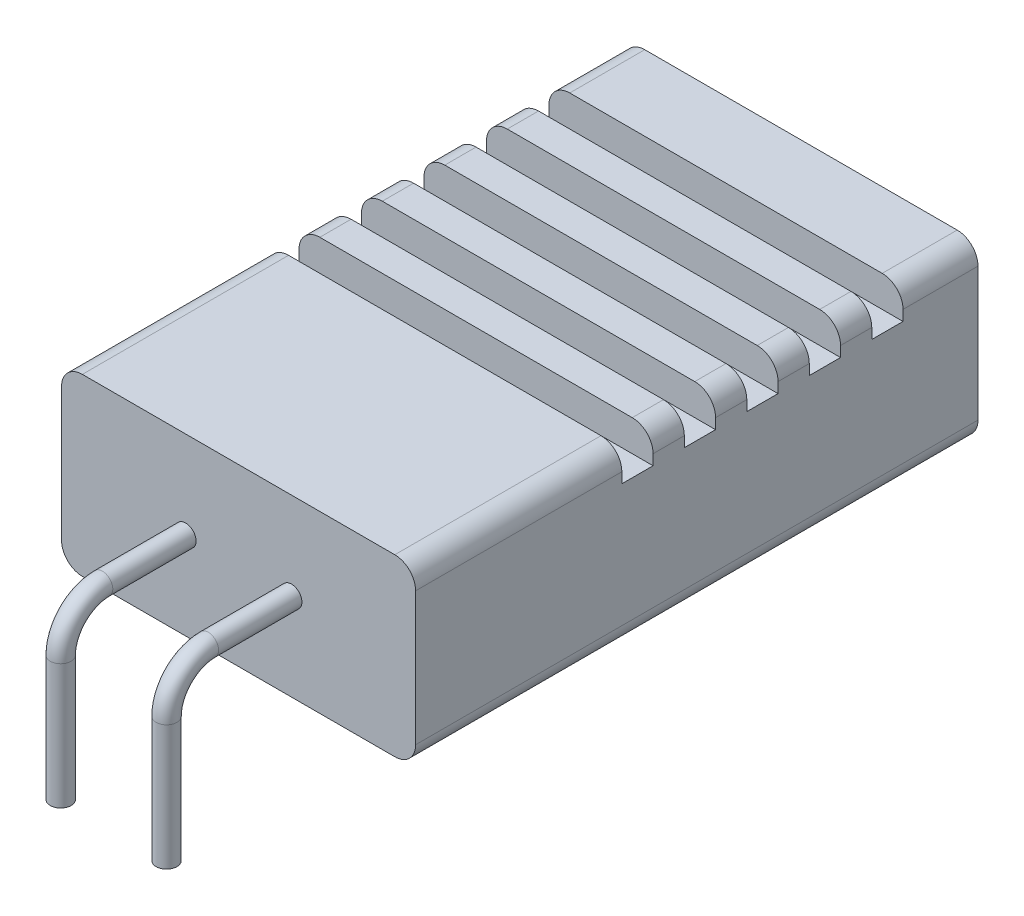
SolidWorks part; units mm, degrees
ref_plane "Plan de face" through (0, 0, 0) normal (0, 0, 1) x (1, 0, 0)
ref_plane "Plan de dessus" through (0, 0, 0) normal (0, 1, 0) x (1, 0, 0)
ref_plane "Plan de droite" through (0, 0, 0) normal (1, 0, 0) x (0, 0, -1)
sketch "Esquisse1" plane through (0, 0, 0) normal (0, 1, 0) x (1, 0, 0)
  line L1 (0, 0) -> (8.5, 0)
  line L2 (0, 0) -> (0, 13.5)
  line L3 (0, 13.5) -> (8.5, 13.5)
  line L4 (8.5, 0) -> (8.5, 13.5)
extrude "Extrusion1" add sketch "Esquisse1" along normal blind 4.2
sketch "Esquisse2" plane through (0, 0, 0) normal (-1, 0, 0) x (0, 0, 1)
  line L0 (-13.5, -0.8137) -> (-13.5, 5.3324) construction
  line L1 (-13.9035, 3.45) -> (0.2887, 3.45) construction
  line L2 (-11.7, 5.3324) -> (-11.7, 3.203) construction
  line L3 (-10.95, 5.3324) -> (-10.95, 3.203) construction
  line L4 (-13.5, 4.2) -> (0, 4.2) construction
  line L5 (-10.2, 3.45) -> (-9.45, 3.45)
  line L6 (-11.7, 3.45) -> (-10.95, 3.45)
  line L7 (-11.7, 3.45) -> (-11.7, 4.2)
  line L8 (-11.7, 4.2) -> (-10.95, 4.2)
  line L9 (-10.95, 3.45) -> (-10.95, 4.2)
  line L10 (-10.2, 3.45) -> (-10.2, 4.2)
  line L11 (-10.2, 4.2) -> (-9.45, 4.2)
  line L12 (-9.45, 3.45) -> (-9.45, 4.2)
  line L13 (-8.7, 3.45) -> (-7.95, 3.45)
  line L14 (-8.7, 3.45) -> (-8.7, 4.2)
  line L15 (-8.7, 4.2) -> (-7.95, 4.2)
  line L16 (-7.95, 3.45) -> (-7.95, 4.2)
  line L17 (-7.2, 3.45) -> (-6.45, 3.45)
  line L18 (-7.2, 3.45) -> (-7.2, 4.2)
  line L19 (-7.2, 4.2) -> (-6.45, 4.2)
  line L20 (-6.45, 3.45) -> (-6.45, 4.2)
  line L21 (-5.7, 3.45) -> (-4.95, 3.45)
  line L22 (-5.7, 3.45) -> (-5.7, 4.2)
  line L23 (-5.7, 4.2) -> (-4.95, 4.2)
  line L24 (-4.95, 3.45) -> (-4.95, 4.2)
  dimension "D1" = 0.75
  dimension "D2" = 1.8
  dimension "D3" = 0.75
extrude "Enlèv. mat.-Extru.1" cut sketch "Esquisse2" against normal through all
fillet "Congé1" radius 0.5 14 edges at (8.5, 0, -6.75) (0, 0, -6.75) (8.5, 4.2, -12.6) (8.5, 4.2, -10.575) (8.5, 4.2, -9.075) (8.5, 4.2, -7.575) (8.5, 4.2, -6.075) (8.5, 4.2, -2.475) (0, 4.2, -2.475) (0, 4.2, -6.075) (0, 4.2, -7.575) (0, 4.2, -9.075) (0, 4.2, -10.575) (0, 4.2, -12.6)
sketch "Esquisse3" plane through (0, 0, 0) normal (0, 0, 1) x (1, 0, 0)
  line L0 (0, -0.4482) -> (0, 4.8701) construction
  line L1 (-0.2744, 0) -> (9.0561, 0) construction
  line L2 (-0.2744, 2.1) -> (9.0561, 2.1) construction
  line L3 (4.25, -0.4482) -> (4.25, 4.8701) construction
  line L4 (5.52, -0.4482) -> (5.52, 2.7104) construction
  circle A0 centre (5.52, 2.1) radius 0.25
  circle A1 centre (2.98, 2.1) radius 0.25
  dimension "D1" = 2.1
  dimension "D2" = 4.25
  dimension "D3" = 1.27
ref_plane "Plan1" through (1.71, 0, 0) normal (1, 0, 0) x (0, 0, -1)
sketch "Esquisse4" plane through (1.71, 0, 0) normal (1, 0, 0) x (0, 0, -1)
  line L0 (0, 2.1) -> (-7.5552, 2.1) construction
  line L1 (0.6054, -1.9) -> (-8.8722, -1.9) construction
  line L2 (-3, 3.2181) -> (-3, -2.7473) construction
  line L3 (0, -0.4482) -> (0, 4.8701) construction
  line L4 (0, 2.1) -> (-2, 2.1)
  line L5 (-3, 1.1) -> (-3, -1.9)
  arc A0 (-2, 2.1) -> (-3, 1.1) centre (-2, 1.1) ccw
  dimension "D3" = 1
  dimension "D1" = 4
  dimension "D2" = 3
sweep "Balayage1" add profiles "Esquisse3" path "Esquisse4"
